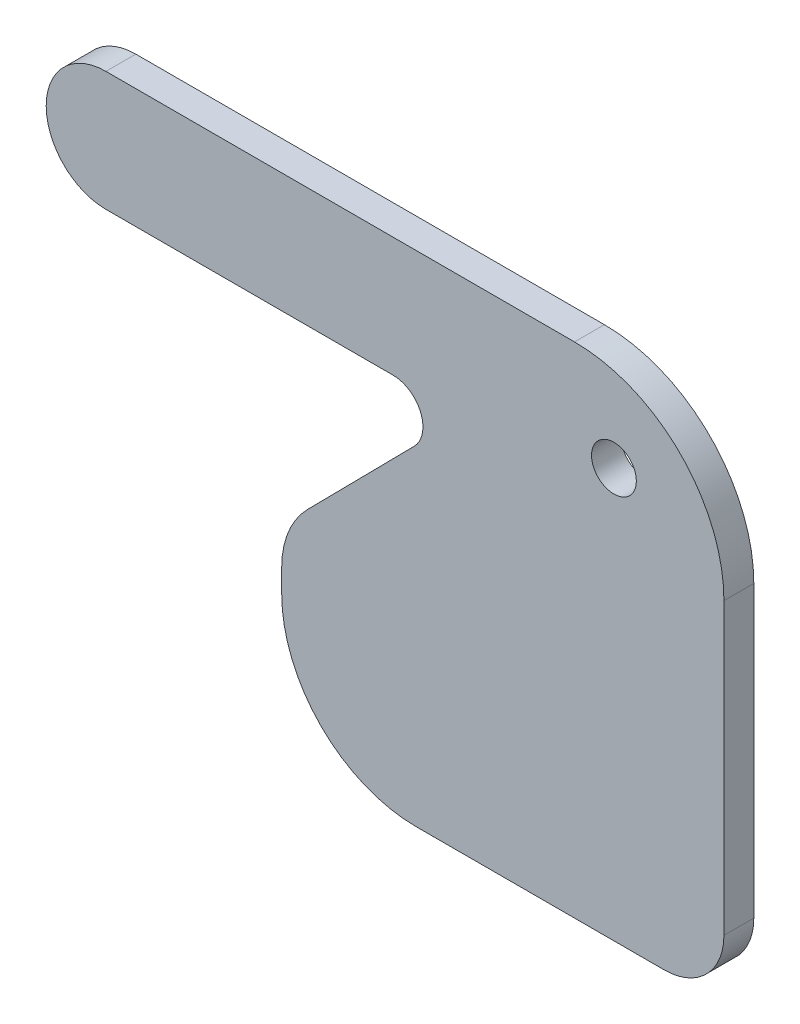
SolidWorks part; units mm, degrees
ref_plane "Plan de face" through (0, 0, 0) normal (0, 0, 1) x (1, 0, 0)
ref_plane "Plan de dessus" through (0, 0, 0) normal (0, 1, 0) x (1, 0, 0)
ref_plane "Plan de droite" through (0, 0, 0) normal (1, 0, 0) x (0, 0, -1)
sketch "Esquisse1" plane through (0, 0, 0) normal (0, 0, 1) x (1, 0, 0)
  line L0 (-111.1839, -137) -> (-111.1839, -84.3101)
  line L1 (-170, 30) -> (-13.1839, 30)
  line L2 (36.8161, -20) -> (36.8161, -117)
  line L6 (-170, -10) -> (-73.9177, -10)
  line L7 (36.8161, -137) -> (80.7447, -137) construction
  line L8 (16.8161, -137) -> (-111.1839, -137)
  line L11 (-66.8, -27.0241) -> (-102.5372, -63.2379)
  circle A0 centre (0, 0) radius 7.5
  arc A1 (-170, 30) -> (-170, -10) centre (-170, 10) ccw
  arc A13 (16.8161, -137) -> (36.8161, -117) centre (16.8161, -117) ccw
  arc A14 (-13.1839, 30) -> (36.8161, -20) centre (-13.1839, -20) cw
  arc A15 (-66.8, -27.0241) -> (-73.9177, -10) centre (-73.9177, -20) ccw
  arc A16 (-111.1839, -84.3101) -> (-102.5372, -63.2379) centre (-81.1839, -84.3101) cw
  point P11 (36.8161, -137)
  point P14 (-50, -10)
  point P24 (-111.1839, -72)
  point P26 (36.8161, 30)
  dimension "D1" = 15
  dimension "D3" = 50
  dimension "D6" = 148
  dimension "D7" = 10
  dimension "D8" = 65
  dimension "D9" = 20
  dimension "D10" = 20
  dimension "D12" = 30
  dimension "D2" = 170
  dimension "D4" = 147
  dimension "D5" = 120
  dimension "D11" = 30
base flange "Tôle de base pliée1" sketch "Esquisse1" thickness 10 reverse thickness direction no parameters "D1"=10
break corner "Coin-brisé1" thickness 10 parameters "D1"=30, "D0"=30, "D7"=5
sketch "Lignes de pliage1" [suppressed] plane through (0, 0, 0) normal (0, 1, 0) x (1, 0, 0)
sketch "Cube de visualisation1" [suppressed] plane through (0, 0, 0) normal (0, 1, 0) x (1, 0, 0)
sheet metal parameters "Tôlerie1" thickness 10 parameters "D1"=10
flat pattern "Etat déplié1"
sketch "Lignes de pliage2" plane through (0, 0, 0) normal (0, 1, 0) x (1, 0, 0)
sketch3d "Cube de visualisation2" [suppressed]
  line L0 (-176.8161, -117, 0) -> (50, -117, 0) construction
  line L1 (-176.8161, 50, 0) -> (50, 50, 0) construction
  line L2 (-176.8161, -117, 0) -> (-176.8161, 50, 0) construction
  line L3 (50, -117, 0) -> (50, 50, 0) construction
